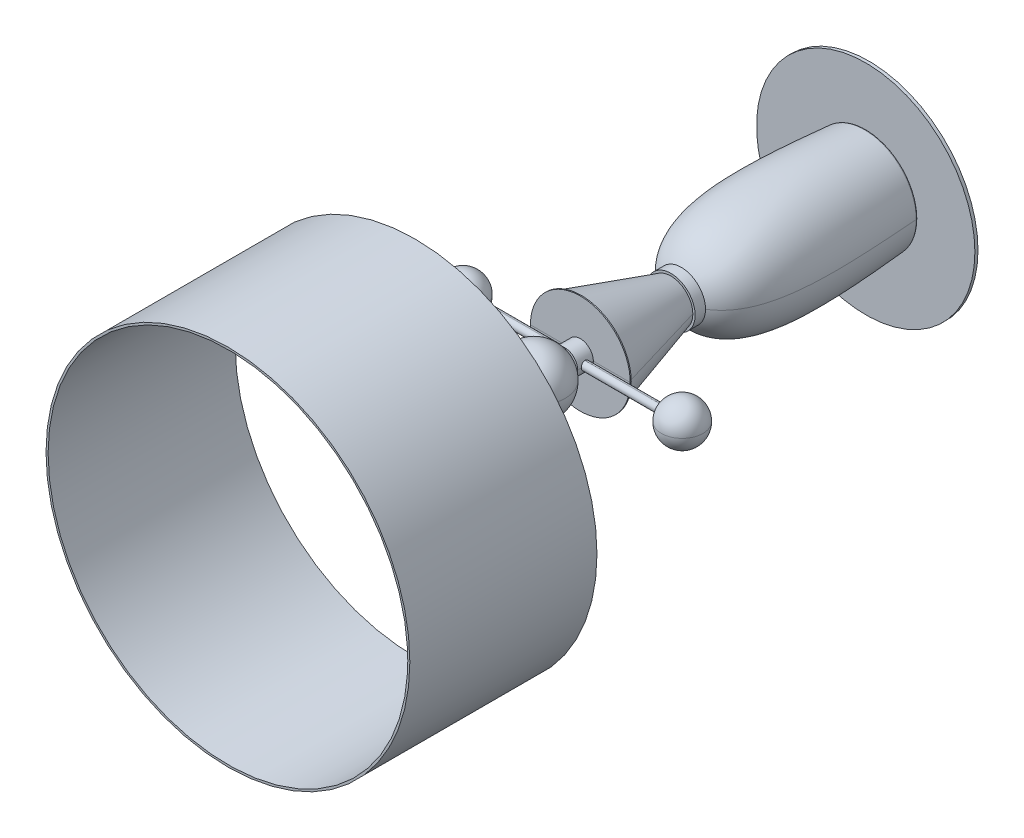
SolidWorks part; units mm, degrees
ref_plane "Alzado" through (0, 0, 0) normal (0, 0, 1) x (1, 0, 0)
ref_plane "Planta" through (0, 0, 0) normal (0, 1, 0) x (1, 0, 0)
ref_plane "Vista lateral" through (0, 0, 0) normal (1, 0, 0) x (0, 0, -1)
imported_body "NURO_C1349.STEP"
delete or keep bodies "Sólido-Eliminar/Conservar 1" type delete bodies bodies 102
delete or keep bodies "Sólido-Eliminar/Conservar 2" type delete bodies bodies 112
delete or keep bodies "Sólido-Eliminar/Conservar 3" type delete bodies bodies 104
delete or keep bodies "Sólido-Eliminar/Conservar 4" type delete bodies bodies 107
delete or keep bodies "Sólido-Eliminar/Conservar 5" type delete bodies bodies 114
delete or keep bodies "Sólido-Eliminar/Conservar 6" type delete bodies bodies 108
delete or keep bodies "Sólido-Eliminar/Conservar 7" type delete bodies bodies 120
delete or keep bodies "Sólido-Eliminar/Conservar 8" type delete bodies bodies 121
delete or keep bodies "Sólido-Eliminar/Conservar 9" type delete bodies bodies 125
delete or keep bodies "Sólido-Eliminar/Conservar 10" type delete bodies bodies 126
delete or keep bodies "Sólido-Eliminar/Conservar 11" type delete bodies bodies 128
delete or keep bodies "Sólido-Eliminar/Conservar 12" type delete bodies bodies 124
delete or keep bodies "Sólido-Eliminar/Conservar 13" type delete bodies bodies 132
delete or keep bodies "Sólido-Eliminar/Conservar 14" type delete bodies bodies 133
delete or keep bodies "Sólido-Eliminar/Conservar 15" type delete bodies bodies 105
delete or keep bodies "Sólido-Eliminar/Conservar 16" type delete bodies bodies 110
delete or keep bodies "Sólido-Eliminar/Conservar 17" type delete bodies bodies 118
delete or keep bodies "Sólido-Eliminar/Conservar 18" type delete bodies bodies 139
delete or keep bodies "Sólido-Eliminar/Conservar 19" type delete bodies bodies 138
delete or keep bodies "Sólido-Eliminar/Conservar 20" type delete bodies bodies 119
delete or keep bodies "Sólido-Eliminar/Conservar 21" type delete bodies bodies 136
delete or keep bodies "Sólido-Eliminar/Conservar 22" type delete bodies bodies 205
delete or keep bodies "Sólido-Eliminar/Conservar 23" type delete bodies bodies 134
delete or keep bodies "Sólido-Eliminar/Conservar 24" type delete bodies bodies 122
delete or keep bodies "Sólido-Eliminar/Conservar 27" type delete bodies bodies 131
delete or keep bodies "Sólido-Eliminar/Conservar 28" type delete bodies bodies 130
delete or keep bodies "Sólido-Eliminar/Conservar 29" type delete bodies bodies 101
delete or keep bodies "Sólido-Eliminar/Conservar 30" type delete bodies bodies 127
delete or keep bodies "Sólido-Eliminar/Conservar 31" type delete bodies bodies 135
delete or keep bodies "Sólido-Eliminar/Conservar 32" type delete bodies bodies 111
delete or keep bodies "Sólido-Eliminar/Conservar 33" type delete bodies bodies 116
ref_plane "Plano1" through (0, 0, 887) normal (0, 0, 1) x (1, 0, 0)
sketch "Croquis2" plane through (0, 0, 887) normal (0, 0, 1) x (1, 0, 0)
  circle A0 centre (-2476.5152, 0) radius 105
  dimension "D1" = 210
extrude "Saliente-Extruir1" add sketch "Croquis2" against normal blind 3 separate body
sketch "Croquis3" plane through (0, 0, 884) normal (0, 0, -1) x (-1, 0, 0)
  line L0 (2476.5152, 0) -> (2476.5152, -80) construction
  circle A0 centre (2476.5152, -80) radius 7.5
  circle A1 centre (2396.5152, 0) radius 7.5
  circle A2 centre (2476.5152, 80) radius 7.5
  circle A3 centre (2556.5152, 0) radius 7.5
  point P13 (2476.5152, 0)
  dimension "D1" = 15
  dimension "D2" = 80
  dimension "D3" = 4
extrude "Saliente-Extruir2" add sketch "Croquis3" along normal blind 8 separate body
fillet "Redondeo1" radius 2 1 edges at (-2564.0152, 0, 876)
fillet "Redondeo2" radius 2 1 edges at (-2484.0152, 80, 876)
fillet "Redondeo3" radius 2 1 edges at (-2484.0152, -80, 876)
fillet "Redondeo4" radius 2 1 edges at (-2404.0152, 0, 876)
sketch "Croquis4" plane through (0, 0, 0) normal (0, 1, 0) x (1, 0, 0)
  line L0 (-2479.5152, -1520.4897) -> (-2473.5152, -1520.4897) construction
  line L1 (-2479.5152, -1288.2486) -> (-2479.5152, -1698.4377) construction
  line L2 (-2473.5152, -1698.4377) -> (-2473.5152, -1288.2486) construction
  line L3 (-2508.8499, -1290.4897) -> (-2448.7272, -1290.4897) construction
  line L4 (-2515.8699, -1720.4897) -> (-2437.1605, -1720.4897)
  line L5 (-2515.8699, -1720.4897) -> (-2515.8699, -1320.4897)
  line L6 (-2515.8699, -1320.4897) -> (-2437.1605, -1320.4897)
  line L7 (-2437.1605, -1720.4897) -> (-2437.1605, -1320.4897)
  line L8 (-2515.8699, -1720.4897) -> (-2437.1605, -1320.4897) construction
  line L9 (-2515.8699, -1320.4897) -> (-2437.1605, -1720.4897) construction
  point P6 (-2476.5152, -1520.4897)
  dimension "D1" = 400
  dimension "D2" = 30
extrude "Cortar-Extruir1" cut sketch "Croquis4" against normal mid plane 18
sketch "Croquis5" plane through (0, 0, 1320.4897) normal (0, 0, 1) x (1, 0, 0)
  circle A0 centre (-2476.5152, 0) radius 175
  circle A1 centre (-2476.5152, 0) radius 173
  dimension "D1" = 350
  dimension "D2" = 346
extrude "Saliente-Extruir3" add sketch "Croquis5" along normal blind 180 separate body
sketch "Croquis6" plane through (0, 0, 1320.4897) normal (0, 0, 1) x (1, 0, 0)
  arc A2 (-2479.5152, 0) -> (-2473.5152, 0) centre (-2476.5152, 0) ccw
  arc A3 (-2473.5152, 0) -> (-2479.5152, 0) centre (-2476.5152, 0) ccw
  arc A4 (-2479.5152, 0) -> (-2473.5152, 0) centre (-2476.5152, 0) ccw
  arc A5 (-2473.5152, 0) -> (-2479.5152, 0) centre (-2476.5152, 0) ccw
  dimension "D1" = 0
extrude "Saliente-Extruir4" add sketch "Croquis6" along normal blind 0.1
sketch "Croquis7" plane through (0, 0, 0) normal (0, 1, 0) x (1, 0, 0)
  line L0 (-2476.5152, -888.2028) -> (-2476.5152, -1069.3919) construction
  line L1 (-2526.344, -888.2028) -> (-2426.6864, -888.2028) construction
  line L2 (-2476.5152, -1069.3919) -> (-2453.2125, -1069.3919) construction
  line L3 (-2453.2125, -1074.3919) -> (-2453.2125, -1064.3919)
  line L4 (-2453.2125, -1064.3919) -> (-2476.5152, -1064.3919)
  line L5 (-2453.2125, -1074.3919) -> (-2476.5152, -1074.3919)
  line L6 (-2476.5152, -1074.3919) -> (-2476.5152, -1064.3919)
  point P8 (-2453.2125, -1069.3919)
  dimension "D1" = 10
revolve "Revolución1" add sketch "Croquis7" angle 360 about L0
